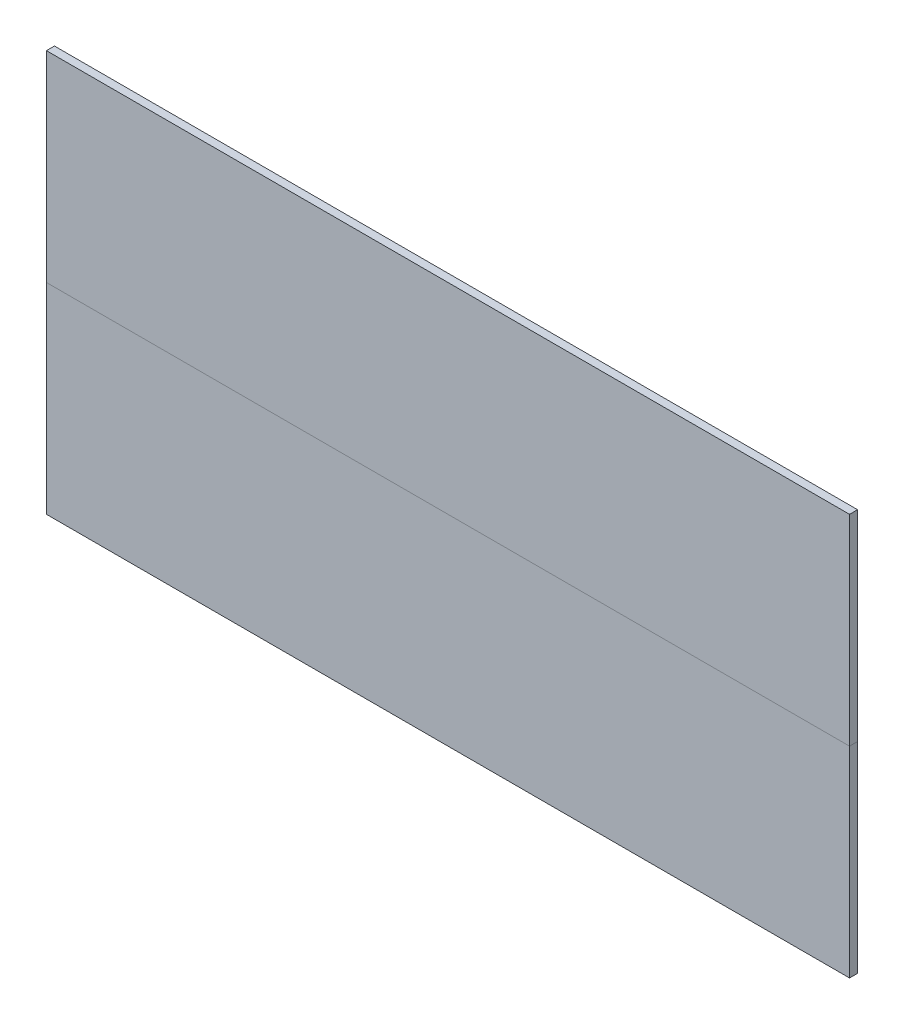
SolidWorks part; units mm, degrees
ref_plane "Front Plane" through (0, 0, 0) normal (0, 0, 1) x (1, 0, 0)
ref_plane "Top Plane" through (0, 0, 0) normal (0, 1, 0) x (1, 0, 0)
ref_plane "Right Plane" through (0, 0, 0) normal (1, 0, 0) x (0, 0, -1)
sketch "Sketch1" plane through (0, 0, 0) normal (0, 0, 1) x (1, 0, 0)
  line L1 (0, 0) -> (100, 0)
  line L2 (0, 0) -> (0, 50)
  line L3 (0, 50) -> (100, 50)
  line L4 (100, 0) -> (100, 50)
  dimension "D1" = 100
  dimension "D2" = 50
extrude "Boss-Extrude1" add sketch "Sketch1" along normal blind 1
ref_plane "Plane1" through (0, 25, 0) normal (0, 1, 0) x (1, 0, 0)
split "Split1" trim tools "Plane1" bodies to split 101 resulting bodies 102 103
